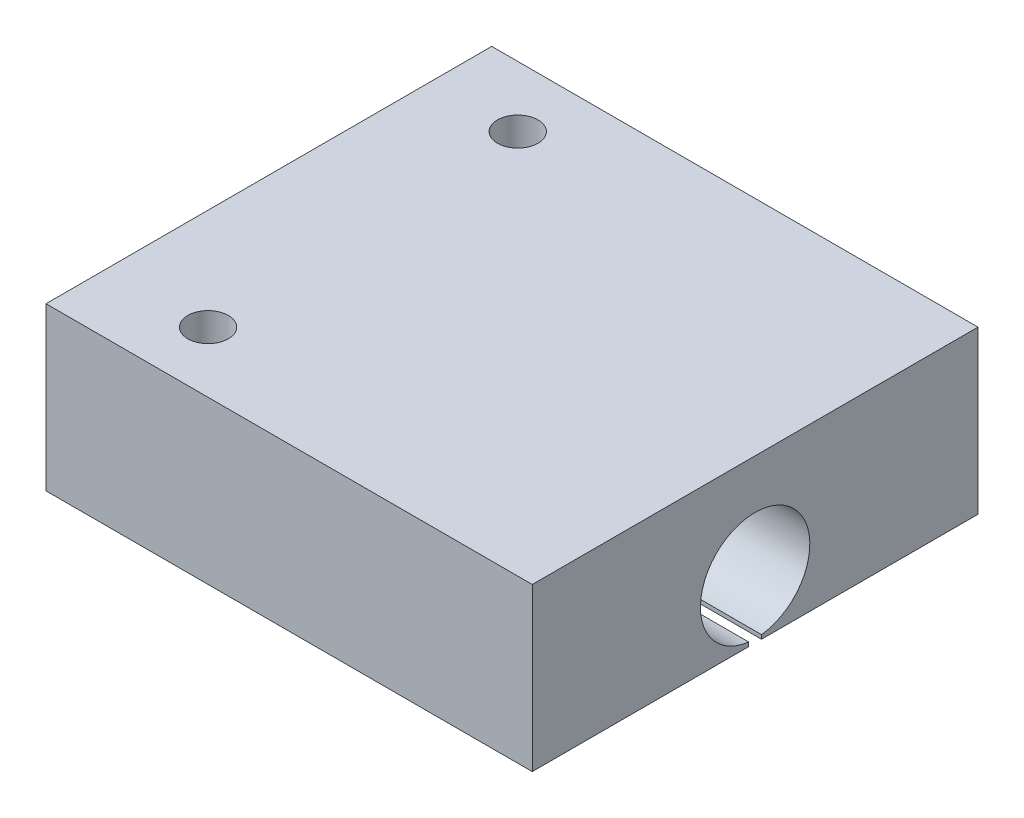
SolidWorks part; units mm, degrees
ref_plane "Front Plane" through (0, 0, 0) normal (0, 0, 1) x (1, 0, 0)
ref_plane "Top Plane" through (0, 0, 0) normal (0, 1, 0) x (1, 0, 0)
ref_plane "Right Plane" through (0, 0, 0) normal (1, 0, 0) x (0, 0, -1)
sketch "Sketch1" plane through (0, 0, 0) normal (0, 1, 0) x (1, 0, 0)
  line L0 (13.599, 60.325) -> (15.875, 9.525) construction
  line L1 (0, 0) -> (76.2, 0)
  line L2 (0, 0) -> (0, 69.85)
  line L3 (0, 69.85) -> (76.2, 69.85)
  line L4 (76.2, 0) -> (76.2, 69.85)
  line L5 (14.737, 34.925) -> (0, 34.925) construction
  circle A0 centre (15.875, 9.525) radius 3.175
  circle A1 centre (13.599, 60.325) radius 3.175
  dimension "D3" = 6.35
  dimension "D5" = 6.35
  dimension "D1" = 76.2
  dimension "D2" = 69.85
  dimension "D4" = 15.875
  dimension "D6" = 50.8
extrude "Boss-Extrude1" add sketch "Sketch1" along normal blind 25.4
sketch "Sketch2" plane through (0, 0, 0) normal (-1, 0, 0) x (0, 0, 1)
  line L0 (-69.85, 0) -> (0, 0) construction
  line L1 (-34.925, 0) -> (-34.925, 9.144) construction
  circle A0 centre (-34.925, 9.144) radius 8.5725
  dimension "D1" = 17.145
  dimension "D2" = 9.144
extrude "Cut-Extrude3" cut sketch "Sketch2" against normal blind 76.2
sketch "Sketch3" plane through (0, 0, 0) normal (0, -1, 0) x (1, 0, 0)
  line L0 (0, -34.925) -> (76.2, -34.925) construction
  line L1 (0, -69.85) -> (0, 0) construction
  line L2 (76.2, 0) -> (76.2, -69.85) construction
  line L4 (0, -33.925) -> (76.2, -33.925)
  line L5 (0, -33.925) -> (0, -35.925)
  line L6 (0, -35.925) -> (76.2, -35.925)
  line L7 (76.2, -33.925) -> (76.2, -35.925)
  dimension "D1" = 2
extrude "Cut-Extrude4" cut sketch "Sketch3" against normal blind 2.54
